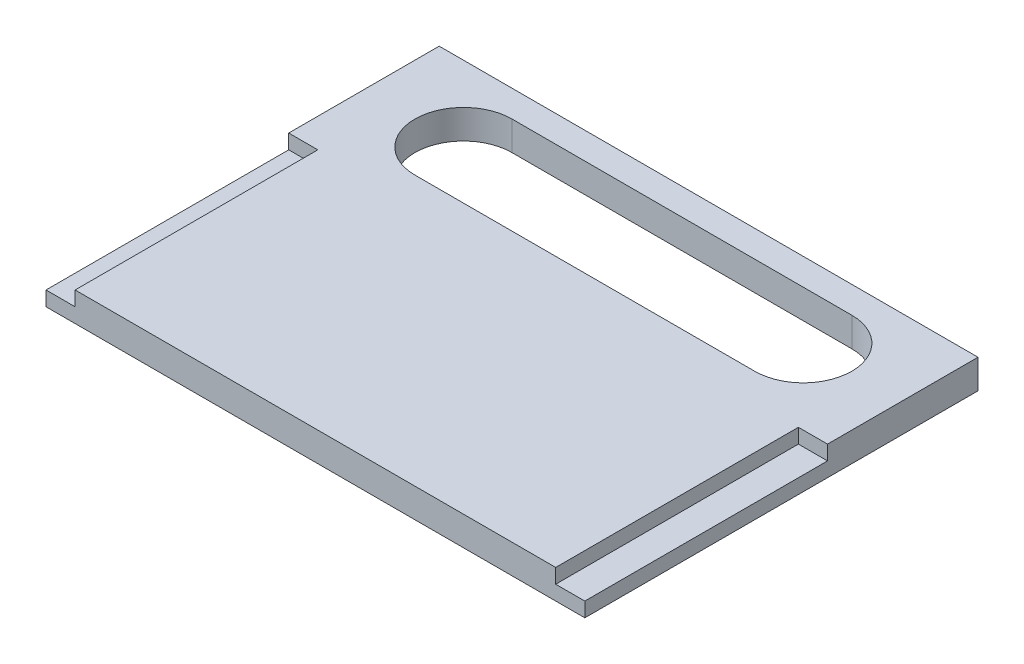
SolidWorks part; units mm, degrees
ref_plane "Plan de face" through (0, 0, 0) normal (0, 0, 1) x (1, 0, 0)
ref_plane "Plan de dessus" through (0, 0, 0) normal (0, 1, 0) x (1, 0, 0)
ref_plane "Plan de droite" through (0, 0, 0) normal (1, 0, 0) x (0, 0, -1)
sketch "Esquisse1" plane through (0, 0, 0) normal (0, 1, 0) x (1, 0, 0)
  line L1 (-55.5, 40.5) -> (55.5, 40.5)
  line L2 (-55.5, 40.5) -> (-55.5, -40.5)
  line L3 (-55.5, -40.5) -> (55.5, -40.5)
  line L4 (55.5, 40.5) -> (55.5, -40.5)
  line L5 (-55.5, 40.5) -> (55.5, -40.5) construction
  line L6 (-55.5, -40.5) -> (55.5, 40.5) construction
  point P0 (0, 0)
  dimension "D1" = 111
  dimension "D2" = 81
extrude "Boss.-Extru.1" add sketch "Esquisse1" along normal blind 6
sketch "Esquisse2" plane through (0, 6, 0) normal (0, 1, 0) x (1, 0, 0)
  line L1 (-55.5, -40.5) -> (-49.5, -40.5)
  line L2 (-55.5, -40.5) -> (-55.5, 9.5)
  line L3 (-55.5, 9.5) -> (-49.5, 9.5)
  line L4 (-49.5, -40.5) -> (-49.5, 9.5)
  dimension "D1" = 6
  dimension "D2" = 50
extrude "Enlèv. mat.-Extru.1" cut sketch "Esquisse2" against normal blind 3
mirror "Symétrie1" about plane through (0, 0, 0) normal (1, 0, 0) of "Enlèv. mat.-Extru.1"
sketch "Esquisse3" plane through (0, 6, 0) normal (0, 1, 0) x (1, 0, 0)
  line L0 (-35, 25) -> (35, 25) construction
  line L1 (-35, 35) -> (35, 35)
  line L2 (-35, 15) -> (35, 15)
  arc A0 (-35, 35) -> (-35, 15) centre (-35, 25) ccw
  arc A1 (35, 15) -> (35, 35) centre (35, 25) ccw
  point P2 (0, 25)
  dimension "D1" = 25
  dimension "D2" = 70
  dimension "D3" = 10
extrude "Enlèv. mat.-Extru.2" cut sketch "Esquisse3" against normal blind 6
